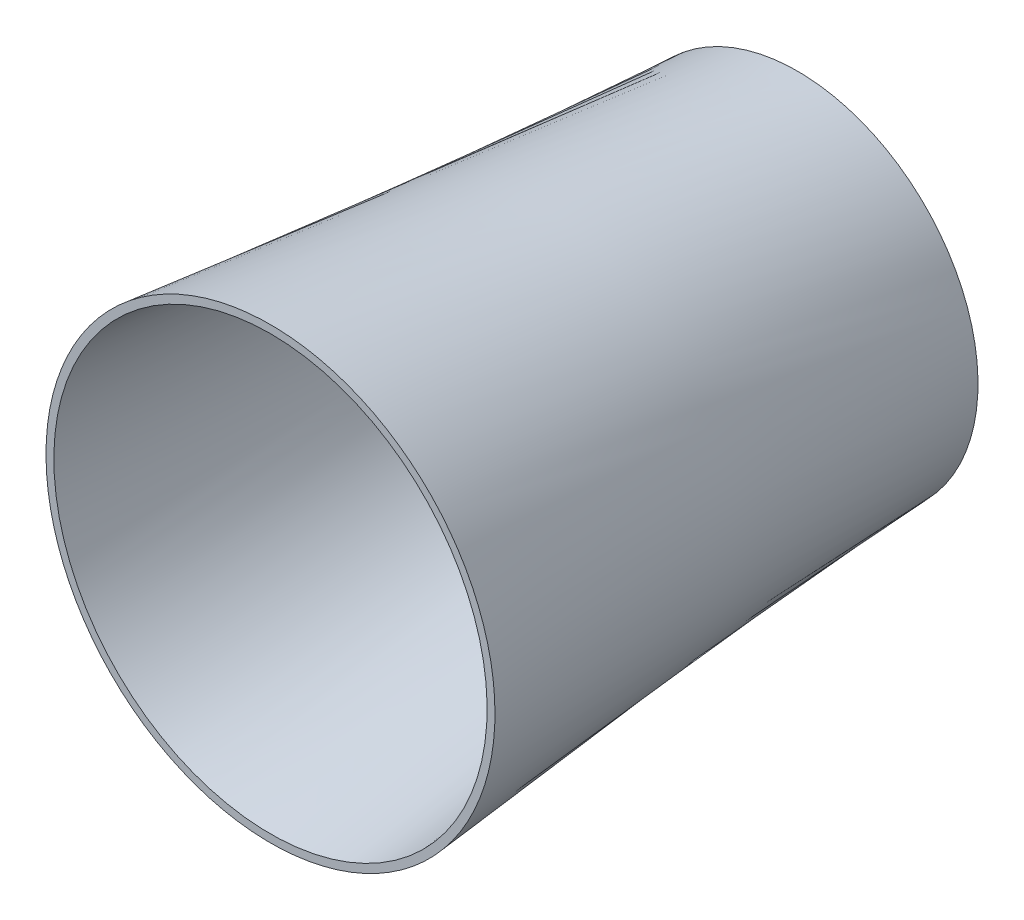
SolidWorks part; units mm, degrees
ref_plane "Front Plane" through (0, 0, 0) normal (0, 0, 1) x (1, 0, 0)
ref_plane "Top Plane" through (0, 0, 0) normal (0, 1, 0) x (1, 0, 0)
ref_plane "Right Plane" through (0, 0, 0) normal (1, 0, 0) x (0, 0, -1)
body saved out of another part "Stock-Second Layer Sleeve-1"
sketch "Sketch1" plane through (0, 0, 270) normal (0, 0, 1) x (1, 0, 0)
  circle A0 centre (0, 0) radius 55.4881
